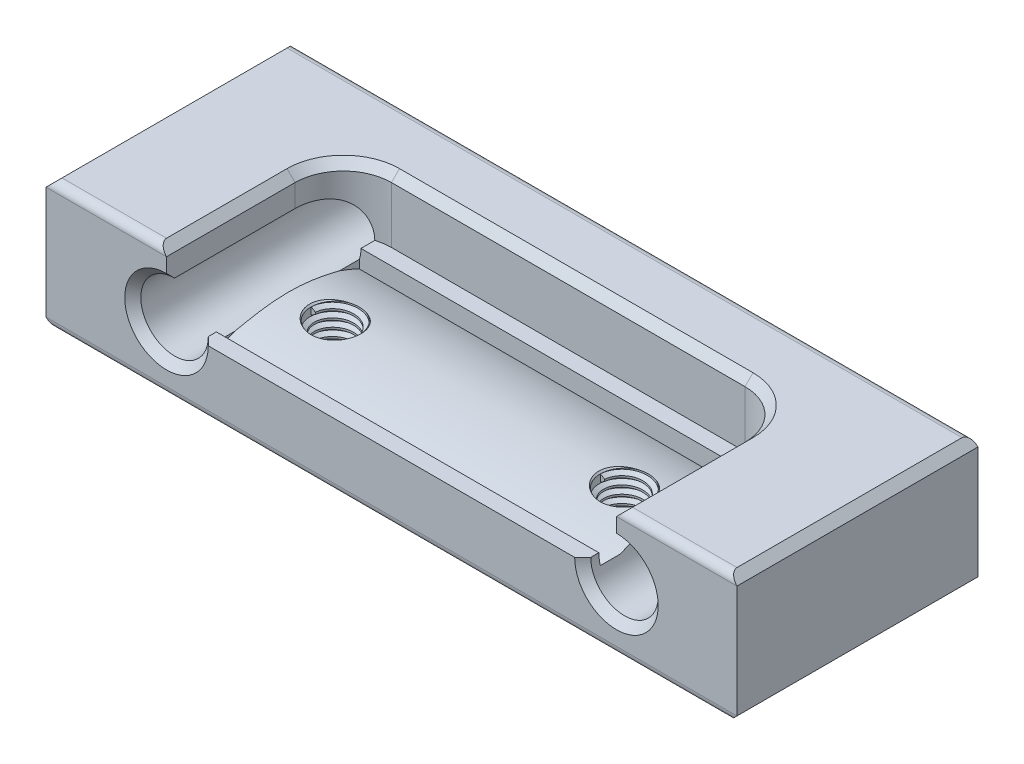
SolidWorks part; units mm, degrees
ref_plane "Спереди" through (0, 0, 0) normal (0, 0, 1) x (1, 0, 0)
ref_plane "Сверху" through (0, 0, 0) normal (0, 1, 0) x (1, 0, 0)
ref_plane "Справа" through (0, 0, 0) normal (1, 0, 0) x (0, 0, -1)
sketch "Эскиз1" plane through (0, 0, 0) normal (0, 1, 0) x (1, 0, 0)
  line L0 (-21.5, -7.5) -> (21.5, 7.5) construction
  line L1 (-21.5, 7.5) -> (21.5, 7.5)
  line L2 (-21.5, 7.5) -> (-21.5, -7.5)
  line L3 (-21.5, -7.5) -> (21.5, -7.5)
  line L4 (21.5, 7.5) -> (21.5, -7.5)
  dimension "D1" = 43
  dimension "D2" = 15
extrude "Бобышка-Вытянуть1" add sketch "Эскиз1" along normal blind 8
sketch "Эскиз2" plane through (0, 8, 0) normal (0, 1, 0) x (1, 0, 0)
  line L0 (-21.5, -7.5) -> (21.5, -7.5) construction
  line L1 (-14, -7.5) -> (14, -7.5)
  line L2 (-14, -7.5) -> (-14, 0.5)
  line L3 (-11, 3.5) -> (11, 3.5)
  line L4 (14, -7.5) -> (14, 0.5)
  line L5 (21.5, -7.5) -> (21.5, 7.5) construction
  arc A0 (14, 0.5) -> (11, 3.5) centre (11, 0.5) ccw
  arc A1 (-14, 0.5) -> (-11, 3.5) centre (-11, 0.5) cw
  point P10 (14, 3.5)
  point P13 (-14, 3.5)
  dimension "D4" = 3
  dimension "D1" = 28
  dimension "D2" = 11
  dimension "D3" = 7.5
extrude "Вырез-Вытянуть1" cut sketch "Эскиз2" against normal blind 4
chamfer "Фаска1" distance 0.5 angle 45 5 edges at (14, 8, 3.5) (13.1213, 8, -2.6213) (0, 8, -3.5) (-13.1213, 8, -2.6213) (-14, 8, 3.5)
chamfer "Фаска2" distance 0.5 angle 45 4 edges at (-21.5, 0, 0) (-21.5, 8, 0) (21.5, 0, 0) (21.5, 8, 0)
fillet "Скругление1" radius 0.5 5 edges at (0, 0, -7.5) (0, 0, 7.5) (0, 8, -7.5) (17.75, 8, 7.5) (-17.75, 8, 7.5)
sketch "Эскиз3" plane through (0, 0, -7.5) normal (0, 0, -1) x (-1, 0, 0)
  line L0 (-21, 8) -> (21, 8) construction
  line L2 (-21.5, 7.5) -> (-21.5, 0.5) construction
  circle A0 centre (-14, 4) radius 2.1
  circle A1 centre (14, 4) radius 2.1
  dimension "D1" = 28
  dimension "D2" = 4
  dimension "D3" = 4
  dimension "D4" = 7.5
extrude "Вырез-Вытянуть2" cut sketch "Эскиз3" against normal through all
chamfer "Фаска3" distance 0.5 angle 45 4 edges at (15.4849, 2.5151, 7.5) (-15.4849, 2.5151, 7.5) (11.9, 4, -7.5) (-16.1, 4, -7.5)
sketch "Эскиз4" plane through (0, 4, 0) normal (0, 1, 0) x (1, 0, 0)
  line L0 (-11.4, -7.5) -> (11.4, -7.5) construction
  line L1 (-21.5, -7.5) -> (-21.5, 7.5) construction
  circle A0 centre (-9, -2) radius 1.5
  circle A1 centre (9, -2) radius 1.5
  dimension "D1" = 18
  dimension "D2" = 5.5
  dimension "D3" = 5.5
  dimension "D4" = 12.5
extrude "Вырез-Вытянуть3" cut sketch "Эскиз4" against normal through all
chamfer "Фаска4" distance 0.2 angle 45 4 edges at (9, 0, 3.5) (9, 4, 3.5) (-9, 0, 3.5) (-9, 4, 3.5)
thread "Резьба2" pitch 0.5 start angle 0, offset 0, length 3.6, pitch 0.5, diameter 3
ref_plane "Плоскость2" through (-10.5, 3.8, 2) normal (0, 0, 1) x (-1, 0, 0)
sketch "Профиль резьбы2" plane through (-10.5, 3.8, 2) normal (0, 0, 1) x (-1, 0, 0)
  line L0 (0, 0) -> (0, 0.5) construction
  line L11 (0, 0) -> (0, 0.4375)
  line L12 (0, 0.4375) -> (-0.2706, 0.2812)
  line L13 (-0.2706, 0.2812) -> (-0.2706, 0.1562)
  line L15 (-0.2706, 0.1562) -> (0, 0)
  line L17 (-0.2706, 0.2187) -> (0, 0.2187) construction
  point P2 (0, 0)
  dimension "Pitch" = 0.5
  dimension "Profile_Angle" = 60
  dimension "Profile_Land" = 0.125
  dimension "Profile_Height" = 0.2706
thread "Резьба3" pitch 0.5 start angle 0, offset 0, length 3.6, pitch 0.5, diameter 3
ref_plane "Плоскость3" through (7.5, 3.8, 2) normal (0, 0, 1) x (-1, 0, 0)
sketch "Профиль резьбы3" plane through (7.5, 3.8, 2) normal (0, 0, 1) x (-1, 0, 0)
  line L0 (0, 0) -> (0, 0.5) construction
  line L11 (0, 0) -> (0, 0.4375)
  line L12 (0, 0.4375) -> (-0.2706, 0.2812)
  line L13 (-0.2706, 0.2812) -> (-0.2706, 0.1562)
  line L15 (-0.2706, 0.1562) -> (0, 0)
  line L17 (-0.2706, 0.2187) -> (0, 0.2187) construction
  point P2 (0, 0)
  dimension "Pitch" = 0.5
  dimension "Profile_Angle" = 60
  dimension "Profile_Land" = 0.125
  dimension "Profile_Height" = 0.2706
sketch "Esquisse1" plane through (0, 0, 0) normal (1, 0, 0) x (0, 0, -1)
  line L4 (-6.5, 2.8421) -> (2.5, 2.8421) construction
  line L5 (-6.5, 2.8421) -> (-6.5, 10.8421)
  line L6 (-6.5, 10.8421) -> (2.5, 10.8421)
  line L7 (2.5, 10.8421) -> (2.5, 2.8421)
  line L8 (-7.5, 7.5) -> (-7.5, 0.5) construction
  line L9 (3.5, 4) -> (3.5, 7.5) construction
  line L10 (3.3618, 4) -> (-7, 4) construction
  arc A1 (2.5, 2.8421) -> (-6.5, 2.8421) centre (-2, -6.2) ccw
  point P9 (-2, 3.9)
  dimension "D3" = 10.1
  dimension "D1" = 1
  dimension "D2" = 1
  dimension "D4" = 0.1
  dimension "D5" = 8
extrude "Enlèv. mat.-Extru.1" cut sketch "Esquisse1" against normal mid plane 24
